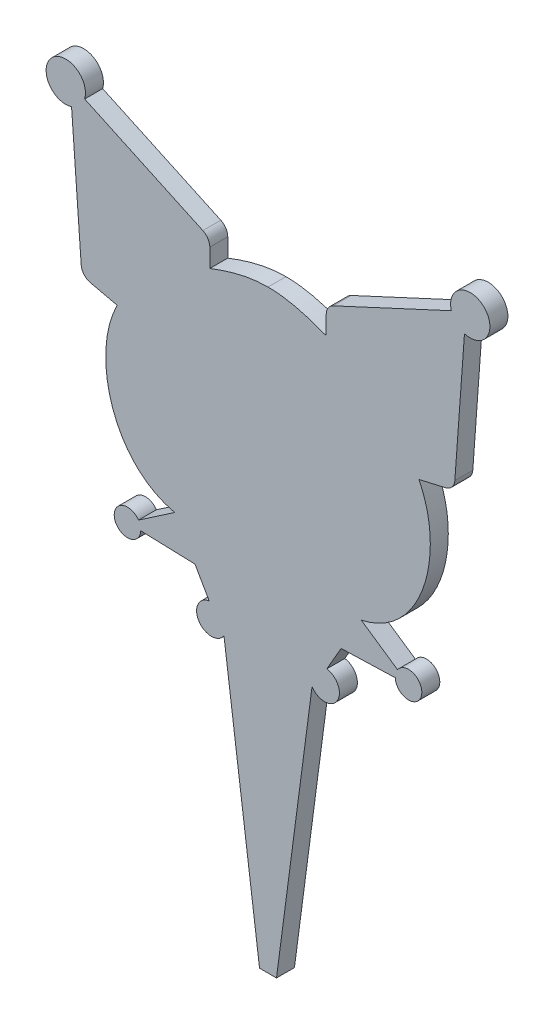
SolidWorks part; units mm, degrees
ref_plane "Alzado" through (0, 0, 0) normal (0, 0, 1) x (1, 0, 0)
ref_plane "Planta" through (0, 0, 0) normal (0, 1, 0) x (1, 0, 0)
ref_plane "Vista lateral" through (0, 0, 0) normal (1, 0, 0) x (0, 0, -1)
sketch "Sketch1" plane through (0, 0, 0) normal (0, 0, 1) x (1, 0, 0)
  line L0 (92.766, 286.1884) -> (462.9769, 286.1884) construction
  line L19 (23.8302, 277.926) -> (30.2647, 189.6906)
  line L32 (36.4555, 182.4748) -> (54.3091, 178.381)
  line L33 (32.5783, 286.8044) -> (111.4964, 250.1713)
  line L34 (116.1281, 242.9149) -> (116.1281, 230.5736)
  line L35 (155, 283.3085) -> (155, 14.4679) construction
  line L36 (68.4935, 61.255) -> (92.7637, 77.8062)
  line L37 (70.0267, 55.8339) -> (106.2145, 54.6888)
  line L38 (106.2145, 54.6888) -> (115.725, 38.1365)
  line L39 (123.921, 35.6849) -> (155, 51.5543)
  line L40 (186.079, 35.6849) -> (155, 51.5543)
  line L41 (203.7855, 54.6888) -> (194.275, 38.1365)
  line L42 (239.9733, 55.8339) -> (203.7855, 54.6888)
  line L43 (241.5065, 61.255) -> (217.2363, 77.8062)
  line L44 (193.8719, 242.9149) -> (193.8719, 230.5736)
  line L45 (277.4217, 286.8044) -> (198.5036, 250.1713)
  line L46 (273.5445, 182.4748) -> (255.6909, 178.381)
  line L47 (286.1698, 277.926) -> (279.7353, 189.6906)
  arc A21 (32.5783, 286.8044) -> (23.8302, 277.926) centre (19.9741, 290.4746) ccw
  arc A22 (68.4935, 61.255) -> (70.0267, 55.8339) centre (61.1689, 56.2562) ccw
  arc A23 (115.725, 38.1365) -> (123.921, 35.6849) centre (117.2538, 28.3216) ccw
  arc A24 (116.1281, 242.9149) -> (111.4964, 250.1713) centre (108.1281, 242.9149) ccw
  arc A25 (30.2647, 189.6906) -> (36.4555, 182.4748) centre (38.2435, 190.2724) ccw
  arc A26 (279.7353, 189.6906) -> (273.5445, 182.4748) centre (271.7565, 190.2724) cw
  arc A27 (193.8719, 242.9149) -> (198.5036, 250.1713) centre (201.8719, 242.9149) cw
  arc A28 (194.275, 38.1365) -> (186.079, 35.6849) centre (192.7462, 28.3216) cw
  arc A29 (241.5065, 61.255) -> (239.9733, 55.8339) centre (248.8311, 56.2562) cw
  arc A30 (277.4217, 286.8044) -> (286.1698, 277.926) centre (290.0259, 290.4746) cw
  spline S0 degree 3 poles (116.1281, 230.5736) (128.5342, 235.3785) (141.4687, 239.2975) (155, 239.2975) knots 0 0 0 0 1 1 1 1
  spline S1 degree 3 poles (54.3091, 178.381) (36.2061, 143.4835) (50.564, 86.9134) (92.7637, 77.8062) knots 0 0 0 0 1 1 1 1
  spline S2 degree 3 poles (255.6909, 178.381) (273.7939, 143.4835) (259.436, 86.9134) (217.2363, 77.8062) knots 0 0 0 0 1 1 1 1
  spline S3 degree 3 poles (193.8719, 230.5736) (181.4658, 235.3785) (168.5313, 239.2975) (155, 239.2975) knots 0 0 0 0 1 1 1 1
  dimension "D1" = 155
  dimension "D2" = 8
extrude "Boss-Extrude1" add sketch "Sketch1" along normal blind 12
sketch "Sketch2" plane through (0, 0, 12) normal (0, 0, 1) x (1, 0, 0)
  line L0 (123.921, 35.6849) -> (149.3459, -157.4367)
  line L1 (186.079, 35.6849) -> (160.6541, -157.4367)
  line L2 (155, 239.2975) -> (155, -105.4367) construction
  line L4 (123.921, 35.6849) -> (155, 71.1263)
  line L5 (155, 71.1263) -> (186.079, 35.6849)
  line L6 (142.5, -105.4367) -> (167.5, -105.4367) construction
  line L7 (149.3459, -157.4367) -> (160.6541, -157.4367)
  dimension "D1" = 15
  dimension "D2" = 7.5
  dimension "D3" = 52
  dimension "D4" = 25
extrude "Boss-Extrude2" add sketch "Sketch2" against normal up to surface (12 mm away)
